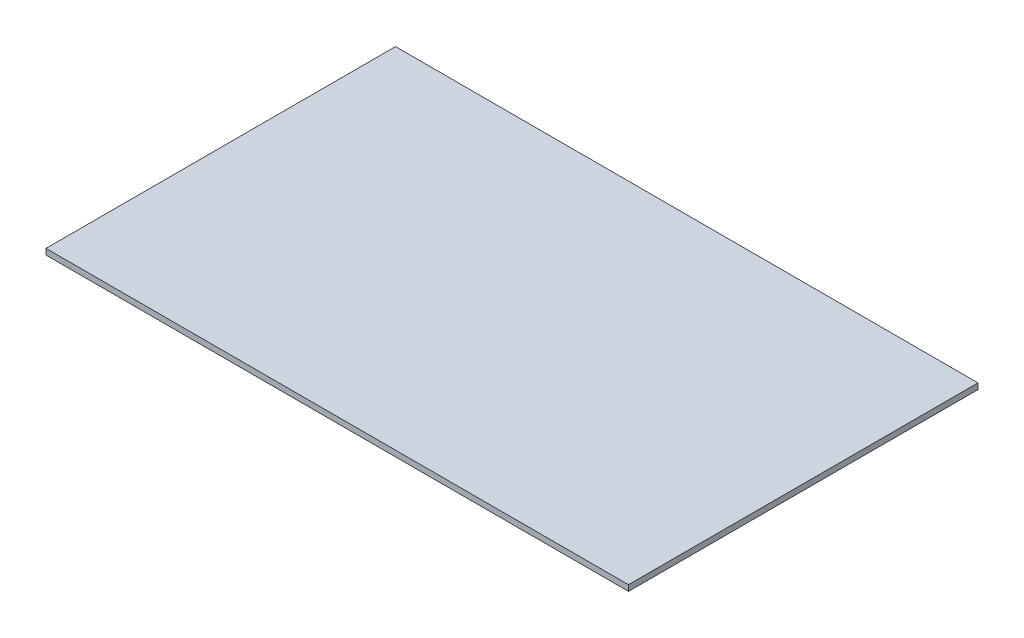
SolidWorks part; units mm, degrees
ref_plane "Plan de face" through (0, 0, 0) normal (0, 0, 1) x (1, 0, 0)
ref_plane "Plan de dessus" through (0, 0, 0) normal (0, 1, 0) x (1, 0, 0)
ref_plane "Plan de droite" through (0, 0, 0) normal (1, 0, 0) x (0, 0, -1)
sketch "Esquisse1" plane through (0, 0, 0) normal (0, 0, 1) x (1, 0, 0)
  line L1 (0, 0) -> (500, 0)
  line L2 (0, 0) -> (0, 5)
  line L3 (0, 5) -> (500, 5)
  line L4 (500, 0) -> (500, 5)
  dimension "D1" = 500
  dimension "D2" = 5
extrude "Extrusion1" add sketch "Esquisse1" along normal blind 300
